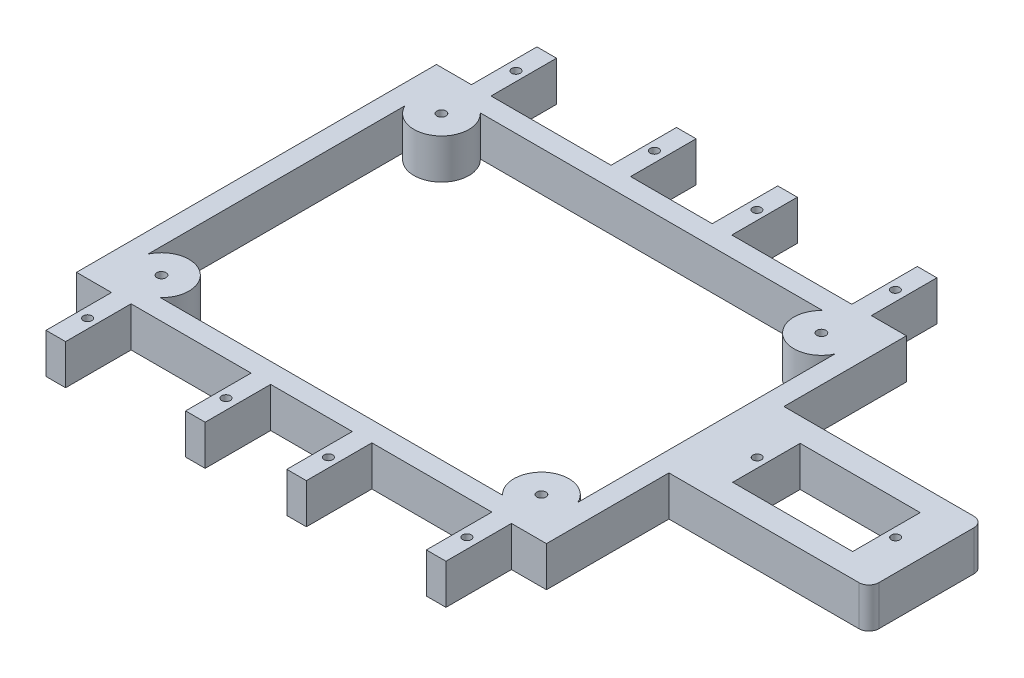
SolidWorks part; units mm, degrees
ref_plane "Front Plane" through (0, 0, 0) normal (0, 0, 1) x (1, 0, 0)
ref_plane "Top Plane" through (0, 0, 0) normal (0, 1, 0) x (1, 0, 0)
ref_plane "Right Plane" through (0, 0, 0) normal (1, 0, 0) x (0, 0, -1)
sketch "草图2" plane through (0, 0, 0) normal (0, 1, 0) x (1, 0, 0)
  line L0 (-47, 36) -> (-47, -36)
  line L1 (-43, 32) -> (43, 32)
  line L2 (-43, 32) -> (-43, -32)
  line L3 (-43, -32) -> (43, -32)
  line L4 (43, 32) -> (43, -32)
  line L5 (-43, 32) -> (43, -32) construction
  line L6 (-43, -32) -> (43, 32) construction
  line L7 (-47, -36) -> (47, -36)
  line L8 (47, 36) -> (47, -36)
  line L9 (-47, 36) -> (47, 36)
  point P0 (0, 0)
  dimension "D1" = 64
  dimension "D2" = 86
  dimension "D3" = 4
extrude "凸台-拉伸1" add sketch "草图2" along normal blind 8
sketch "草图3" plane through (0, 8, 0) normal (0, 1, 0) x (1, 0, 0)
  line L0 (0, 0) -> (84.4944, 0) construction
  line L1 (0, 0) -> (0, -63.9964) construction
  line L2 (-47, -36) -> (47, -36) construction
  line L3 (36.0823, -36) -> (40, -36)
  line L4 (36.0823, -36) -> (36.0823, -49.1)
  line L5 (36.0823, -49.1) -> (40, -49.1)
  line L6 (40, -36) -> (40, -49.1)
  line L8 (12.0823, -36) -> (8.1646, -36)
  line L9 (12.0823, -36) -> (12.0823, -49.1)
  line L10 (12.0823, -49.1) -> (8.1646, -49.1)
  line L11 (8.1646, -36) -> (8.1646, -49.1)
  line L12 (-36.0823, -49.1) -> (-40, -49.1)
  line L13 (-40, -36) -> (-40, -49.1)
  line L14 (-36.0823, -36) -> (-40, -36)
  line L15 (-36.0823, -36) -> (-36.0823, -49.1)
  line L16 (-12.0823, -49.1) -> (-8.1646, -49.1)
  line L17 (-12.0823, -36) -> (-12.0823, -49.1)
  line L18 (-8.1646, -36) -> (-8.1646, -49.1)
  line L19 (-12.0823, -36) -> (-8.1646, -36)
  line L20 (-12.0823, 49.1) -> (-8.1646, 49.1)
  line L21 (-8.1646, 36) -> (-8.1646, 49.1)
  line L22 (-12.0823, 36) -> (-8.1646, 36)
  line L23 (-12.0823, 36) -> (-12.0823, 49.1)
  line L24 (-36.0823, 49.1) -> (-40, 49.1)
  line L25 (-36.0823, 36) -> (-36.0823, 49.1)
  line L26 (-36.0823, 36) -> (-40, 36)
  line L27 (-40, 36) -> (-40, 49.1)
  line L28 (36.0823, 49.1) -> (40, 49.1)
  line L29 (40, 36) -> (40, 49.1)
  line L30 (36.0823, 36) -> (40, 36)
  line L31 (36.0823, 36) -> (36.0823, 49.1)
  line L32 (12.0823, 36) -> (12.0823, 49.1)
  line L33 (12.0823, 49.1) -> (8.1646, 49.1)
  line L34 (12.0823, 36) -> (8.1646, 36)
  line L35 (8.1646, 36) -> (8.1646, 49.1)
  line L42 (47, -36) -> (47, 36) construction
  circle A0 centre (10.2431, -42.85) radius 0.85
  circle A1 centre (37.9431, -42.85) radius 0.85
  circle A2 centre (-37.9431, -42.85) radius 0.85
  circle A3 centre (-10.2431, -42.85) radius 0.85
  circle A4 centre (-10.2431, 42.85) radius 0.85
  circle A5 centre (-37.9431, 42.85) radius 0.85
  circle A6 centre (37.9431, 42.85) radius 0.85
  circle A7 centre (10.2431, 42.85) radius 0.85
  dimension "D5" = 1.7
  dimension "D1" = 7
  dimension "D2" = 13.1
  dimension "D3" = 24
  dimension "D4" = 2.0569
  dimension "D6" = 27.7
  dimension "D7" = 6.85
extrude "凸台-拉伸2" add sketch "草图3" against normal up to surface (8 mm away)
fillet "圆角1" radius 5 4 edges at (-43, 4, 32) (43, 4, 32) (-43, 4, -32) (43, 4, -32)
sketch "草图4" plane through (0, 0, 0) normal (0, -1, 0) x (1, 0, 0)
  line L0 (47, 36) -> (47, -36) construction
  line L1 (12.0823, 36) -> (36.0823, 36) construction
  circle A0 centre (-38, 28) radius 5.5
  circle A1 centre (38, 28) radius 5.5
  circle A2 centre (-38, -28) radius 5.5
  circle A3 centre (38, -28) radius 5.5
  circle A4 centre (-38, 28) radius 0.9
  circle A5 centre (38, 28) radius 0.9
  circle A6 centre (38, -28) radius 0.9
  circle A7 centre (-38, -28) radius 0.9
  dimension "D7" = 11
  dimension "D8" = 1.8
  dimension "D1" = 9
  dimension "D2" = 76
  dimension "D3" = 56
  dimension "D4" = 76
  dimension "D5" = 56
  dimension "D6" = 8
extrude "凸台-拉伸3" add sketch "草图4" against normal up to surface (8 mm away)
sketch "草图5" plane through (47, 0, 0) normal (1, 0, 0) x (0, 0, -1)
  line L0 (0, 0) -> (0, 28.5292) construction
  line L2 (-11.5, 8) -> (11.5, 8)
  line L3 (-11.5, 8) -> (-11.5, 0)
  line L4 (-11.5, 0) -> (11.5, 0)
  line L5 (11.5, 8) -> (11.5, 0)
  line L6 (-36, 0) -> (36, 0) construction
  point P11 (0, 0)
  dimension "D1" = 8
  dimension "D2" = 23
extrude "凸台-拉伸4" add sketch "草图5" along normal blind 40
sketch "草图6" plane through (0, 8, 0) normal (0, 1, 0) x (1, 0, 0)
  line L0 (47, 0) -> (87, 0) construction
  line L2 (87, 11.5) -> (87, -11.5) construction
  line L3 (67, 11.5) -> (67, -11.5) construction
  line L4 (87, 11.5) -> (47, 11.5) construction
  line L5 (87, -11.5) -> (47, -11.5) construction
  line L7 (55, 6.75) -> (79, 6.75)
  line L8 (55, 6.75) -> (55, -6.75)
  line L9 (55, -6.75) -> (79, -6.75)
  line L10 (79, 6.75) -> (79, -6.75)
  line L11 (55, 6.75) -> (79, -6.75) construction
  line L12 (55, -6.75) -> (79, 6.75) construction
  point P12 (67, 0)
  point P17 (0, 0)
  dimension "D1" = 13.5
  dimension "D2" = 24
extrude "切除-拉伸1" cut sketch "草图6" against normal through all
sketch "草图7" plane through (0, 8, 0) normal (0, 1, 0) x (1, 0, 0)
  circle A0 centre (80.85, 0) radius 0.85
  circle A1 centre (53.15, 0) radius 0.85
  dimension "D1" = 1.7
extrude "切除-拉伸2" cut sketch "草图7" against normal up to next
fillet "圆角2" radius 2 2 edges at (87, 4, -11.5) (87, 4, 11.5)
